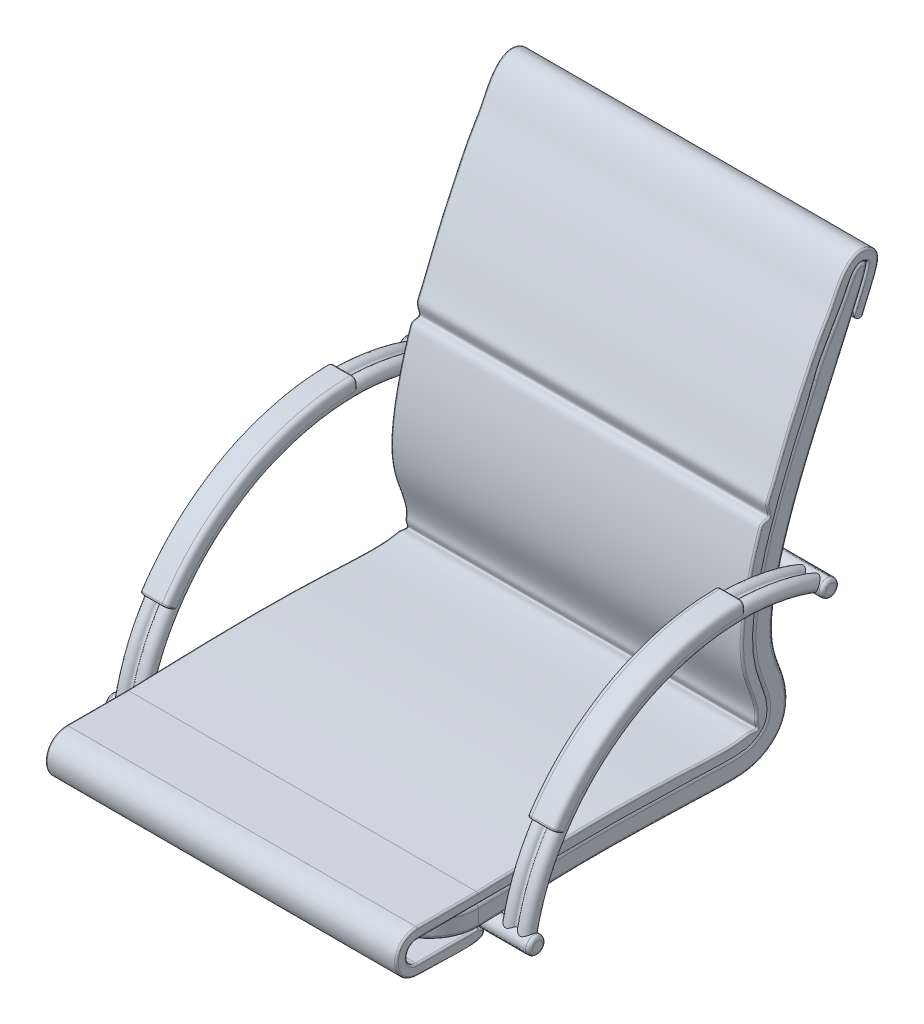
SolidWorks part; units mm, degrees
ref_plane "Front Plane" through (0, 0, 0) normal (0, 0, 1) x (1, 0, 0)
ref_plane "Top Plane" through (0, 0, 0) normal (0, 1, 0) x (1, 0, 0)
ref_plane "Right Plane" through (0, 0, 0) normal (1, 0, 0) x (0, 0, -1)
sketch "Sketch4" plane through (0, 0, 0) normal (1, 0, 0) x (0, 0, -1)
  line L0 (218.1303, 668.8913) -> (231.2948, 8.3441) construction
  circle A0 centre (218.1303, 668.8913) radius 12.0924
  circle A1 centre (231.2948, 8.3441) radius 12.1449 construction
extrude "Boss-Extrude2" add sketch "Sketch4" along normal mid plane 606 separate body
ref_plane "Plane1" through (276, 0, 0) normal (1, 0, 0) x (0, 0, -1)
sketch "Sketch5" plane through (276, 0, 0) normal (1, 0, 0) x (0, 0, -1)
  line L0 (218.1303, 656.7989) -> (218.1303, 680.9837) construction
  circle A0 centre (218.1303, 668.8913) radius 12.0924 construction
  spline S1 degree 3 poles (-199.6989, 437.1675) (-196.5427, 454.7327) (-189.8873, 480.4216) (-176.82, 512.9804) (-164.8811, 535.9342) (-146.7072, 565.2538) (-124.7381, 592.2419) (-99.9188, 616.3121) (-79.3824, 632.3791) (-58.0783, 647.0467) (-35.6892, 659.9192) (-12.0144, 670.1434) (12.3733, 678.9136) (37.6554, 685.3594) (63.172, 690.0447) (88.9718, 691.923) (114.7332, 692.5477) (140.4632, 690.0125) (165.9734, 685.984) (188.6281, 680.4159) (205.9265, 674.4142) (214.8168, 670.5993) (218.1303, 669.0613) knots 0 0 0 0 0.099648 0.147663 0.195628 0.243945 0.340141 0.388961 0.436781 0.485552 0.533339 0.580717 0.629379 0.677921 0.726265 0.774036 0.822241 0.869971 0.918165 0.966412 1 1.020341 1.020341 1.020341 1.020341
ref_plane "Plane2" through (276, 437.1675, 199.6989) normal (0, 0.9842, -0.1769) x (-1, 0, 0)
sketch "Sketch6" plane through (276, 437.1675, 199.6989) normal (0, 0.9842, -0.1769) x (-1, 0, 0)
  line L6 (20.4166, 0) -> (0.3884, 0) construction
  line L7 (0, 0) -> (0, 0.9296) construction
  line L10 (-0.3849, 5) -> (0.3849, 5)
  line L11 (-0.3849, -5) -> (0.3849, -5)
  arc A0 (2.3861, -6.0017) -> (2.3861, 6.0017) centre (10.4025, 0) ccw
  arc A1 (-2.3861, -6.0017) -> (-2.3861, 6.0017) centre (-10.4025, 0) cw
  arc A2 (2.3861, -6.0017) -> (0.3849, -5) centre (0.3849, -7.5) ccw
  arc A3 (-2.3861, -6.0017) -> (-0.3849, -5) centre (-0.3849, -7.5) cw
  arc A4 (2.3861, 6.0017) -> (0.3849, 5) centre (0.3849, 7.5) cw
  arc A5 (-2.3861, 6.0017) -> (-0.3849, 5) centre (-0.3849, 7.5) ccw
  dimension "D1" = 2.5
sketch "Sketch2" plane through (0, 0, 0) normal (1, 0, 0) x (0, 0, -1)
  arc A0 (-302.7004, 447.073) -> (-302.8358, 477.0727) centre (-302.768, 462.0728) cw
  spline S0 degree 3 poles (-302.768, 462.0728) (-254.4457, 462.291) (-173.1643, 465.1968) (-60.3682, 468.2628) (28.1402, 466.1167) (95.8151, 463.9645) (137.6273, 462.2826) (161.3142, 466.099) (177.9271, 474.807) (191.2571, 488.7092) (195.9209, 508.6286) (194.0692, 533.8347) (181.9926, 559.9308) (171.6561, 602.0238) (176.8481, 649.3974) (191.4753, 706.434) (212.6276, 768.554) (238.3255, 828.8707) (274.2937, 907.0396) (299.4763, 958.7263) (317.708, 996.574) knots 0 0 0 0 0.139411 0.234711 0.325542 0.394767 0.430232 0.446073 0.463281 0.483676 0.499234 0.520862 0.555435 0.581355 0.645155 0.68964 0.751713 0.834106 0.878774 1 1 1 1 construction
  spline S2 degree 3 number of poles 65 (-302.7004, 447.073) -> (265.2147, 851.3283)
  spline S4 degree 3 poles (-302.8358, 477.0727) (-292.0663, 477.1213) (-270.54, 477.369) (-227.3985, 478.3123) (-173.3608, 480.0335) (-119.1146, 481.7129) (-75.5578, 482.4358) (-42.7989, 482.4694) (-10.1258, 481.9926) (22.4709, 481.1965) (49.5556, 480.4101) (71.2346, 479.7336) (87.5038, 479.1907) (101.0563, 478.7138) (111.9355, 478.2995) (119.8779, 478.0291) (127.6177, 477.9159) (135.1406, 478.0514) (141.2527, 478.4479) (146.0026, 478.9689) (149.3577, 479.4731) (152.5123, 480.1146) (155.425, 480.9002) (158.142, 481.8563) (161.7542, 483.4398) (166.1215, 485.9539) (170.2403, 489.15) (172.9882, 491.8447) (174.757, 493.9117) (175.9591, 495.6331) (176.7585, 497.0016) (177.4406, 498.3393) (178.2025, 500.2112) (178.9544, 502.7818) (179.5239, 505.6281) (180.0354, 509.7542) (180.1877, 515.064) (179.7125, 520.4534) (178.9806, 524.7698) (178.0217, 529.071) (176.3732, 534.6772) (173.8388, 541.7893) (170.9605, 549.3431) (168.4855, 556.0807) (166.6316, 561.7474) (164.9304, 567.4447) (163.0775, 574.6813) (161.3382, 583.5114) (160.1339, 592.4791) (159.2507, 604.3805) (159.3374, 619.1555) (160.9298, 636.5856) (163.6168, 653.6226) (168.1318, 675.7027) (175.1793, 702.5561) (185.0612, 734.1263) (196.1577, 765.29) (208.2138, 795.9408) (225.1757, 835.9888) (238.6121, 865.467) (247.6824, 884.9305) knots 0 0 0 0 0.03125 0.0625 0.125 0.1875 0.21875 0.25 0.28125 0.3125 0.34375 0.359375 0.375 0.390625 0.398438 0.40625 0.414062 0.421875 0.429688 0.433594 0.4375 0.441406 0.445312 0.449219 0.453125 0.460938 0.46875 0.472656 0.476562 0.480469 0.482422 0.484375 0.488281 0.492188 0.496094 0.5 0.507812 0.515625 0.519531 0.523438 0.53125 0.539062 0.546875 0.554688 0.558594 0.5625 0.570312 0.578125 0.585938 0.59375 0.609375 0.625 0.640625 0.65625 0.6875 0.71875 0.75 0.78125 0.8125 0.874209 0.874209 0.874209 0.874209
  spline S5 degree 3 poles (247.6824, 884.9305) (260.0079, 917.9066) (285.1481, 950.0096) (302.7474, 992.2646) (313.1618, 997.7348) (317.8391, 996.6841) (320.5436, 995.2701) (323.0924, 994.2624) (324.3018, 992.1736) (323.5022, 988.3225) (321.897, 981.468) (316.8688, 968.57) (307.5815, 946.9094) (289.7463, 906.8502) (274.8552, 873.5253) (265.2147, 851.3283) knots 0 0 0 0 0.347874 0.422119 0.446285 0.457369 0.469073 0.477455 0.484417 0.491273 0.516071 0.556561 0.630422 0.755115 1 1 1 1
sweep "Sweep3" add profiles "Sketch6" path "Sketch5"
ref_plane "Plane3" through (250, 0, 0) normal (1, 0, 0) x (0, 0, -1)
sketch "Sketch7" plane through (250, 0, 0) normal (1, 0, 0) x (0, 0, -1)
  arc A0 (-232.2731, 478.2649) -> (-231.282, 448.2874) centre (-232.2731, 463.2598) ccw
  spline S0 degree 1 poles (-231.543, 458.284) (255.9032, 855.3113) knots 0 0 1 1 construction
  spline S1 degree 3 poles (247.6824, 884.9305) (260.0079, 917.9066) (285.1481, 950.0096) (302.7474, 992.2646) (313.1618, 997.7348) (317.8391, 996.6841) (320.5436, 995.2701) (323.0924, 994.2624) (324.3018, 992.1736) (323.5022, 988.3225) (321.8971, 981.468) (316.8685, 968.5701) (307.5842, 946.9082) (289.6874, 906.7854) (274.8938, 873.3268) (264.9972, 851.1521) knots 0 0 0 0 0.347582 0.421765 0.44591 0.456985 0.46868 0.477054 0.48401 0.490861 0.515638 0.556094 0.629893 0.754481 1 1 1 1
  spline S2 degree 3 poles (-231.543, 458.284) (-214.5776, 458.7271) (-180.6414, 459.7711) (-129.796, 461.3657) (-87.4532, 462.2791) (-53.6241, 462.4178) (-28.2337, 462.201) (-2.828, 461.7221) (22.5779, 461.0754) (48.0034, 460.3385) (73.4009, 459.5358) (94.6065, 458.8163) (111.5185, 458.1566) (124.3884, 457.7453) (135.2405, 457.8819) (144.0017, 458.5027) (150.6288, 459.2832) (157.3256, 460.5595) (166.2059, 463.2312) (174.5012, 467.4856) (182.0062, 473.003) (187.225, 477.832) (191.0191, 482.4559) (193.5954, 486.5117) (195.8255, 490.8439) (197.8126, 496.4901) (199.1929, 503.4257) (199.7977, 510.3181) (199.7531, 517.1893) (199.1005, 523.9538) (197.872, 530.6639) (196.1831, 537.0935) (193.4685, 545.448) (190.3971, 553.4733) (187.4755, 561.3438) (184.8307, 569.1648) (182.1388, 579.0969) (179.273, 595.1773) (178.5907, 615.696) (181.2366, 640.7269) (186.085, 665.5888) (192.2644, 689.9565) (199.4739, 714.1593) (207.4689, 738.1677) (219.0709, 769.9015) (235.0436, 808.9994) (248.8647, 839.9219) (255.9032, 855.3113) knots 0.068734 0.068734 0.068734 0.068734 0.117683 0.166633 0.215582 0.240057 0.264532 0.289006 0.313481 0.337956 0.362431 0.386906 0.399143 0.41138 0.423618 0.429736 0.435855 0.441974 0.448092 0.46033 0.466448 0.472567 0.478686 0.481745 0.484805 0.490923 0.497042 0.503161 0.509279 0.515398 0.521517 0.527635 0.533754 0.545991 0.55211 0.558229 0.570466 0.582704 0.607178 0.631653 0.656128 0.680603 0.705077 0.729552 0.754027 0.802976 0.851926 0.851926 0.851926 0.851926 construction
  spline S3 degree 3 poles (-232.2731, 478.2649) (-212.6501, 478.782) (-171.383, 480.0947) (-119.1146, 481.7129) (-75.5578, 482.4358) (-42.7989, 482.4694) (-10.1258, 481.9926) (22.4709, 481.1965) (49.5556, 480.4101) (71.2346, 479.7336) (87.5038, 479.1907) (101.0563, 478.7138) (111.9355, 478.2995) (119.8779, 478.0291) (127.6177, 477.9159) (135.1406, 478.0514) (141.2527, 478.4479) (146.0026, 478.9689) (149.3577, 479.4731) (152.5123, 480.1146) (155.425, 480.9002) (158.142, 481.8563) (161.7542, 483.4398) (166.1215, 485.9539) (170.2403, 489.15) (172.9882, 491.8447) (174.757, 493.9117) (175.9591, 495.6331) (176.7585, 497.0016) (177.4406, 498.3393) (178.2025, 500.2112) (178.9544, 502.7818) (179.5239, 505.6281) (180.0354, 509.7542) (180.1877, 515.064) (179.7125, 520.4534) (178.9806, 524.7698) (178.0217, 529.071) (176.3732, 534.6772) (173.8388, 541.7893) (170.9605, 549.3431) (168.4855, 556.0807) (166.6316, 561.7474) (164.9304, 567.4447) (163.0775, 574.6813) (161.3382, 583.5114) (160.1339, 592.4791) (159.2507, 604.3805) (159.3374, 619.1555) (160.9298, 636.5856) (163.6168, 653.6226) (168.1318, 675.7027) (175.1793, 702.5561) (185.0612, 734.1263) (196.1577, 765.29) (208.2138, 795.9408) (225.1757, 835.9888) (238.6121, 865.467) (247.6824, 884.9305) knots 0.068197 0.068197 0.068197 0.068197 0.125 0.1875 0.21875 0.25 0.28125 0.3125 0.34375 0.359375 0.375 0.390625 0.398438 0.40625 0.414062 0.421875 0.429688 0.433594 0.4375 0.441406 0.445312 0.449219 0.453125 0.460938 0.46875 0.472656 0.476562 0.480469 0.482422 0.484375 0.488281 0.492188 0.496094 0.5 0.507812 0.515625 0.519531 0.523438 0.53125 0.539062 0.546875 0.554688 0.558594 0.5625 0.570312 0.578125 0.585938 0.59375 0.609375 0.625 0.640625 0.65625 0.6875 0.71875 0.75 0.78125 0.8125 0.874209 0.874209 0.874209 0.874209
  spline S4 degree 3 poles (-231.282, 448.2874) (-211.7381, 448.7979) (-181.3855, 449.7535) (-140.2881, 451.0176) (-107.9187, 451.8553) (-75.6149, 452.3787) (-43.3952, 452.4007) (-11.0883, 451.9186) (21.2816, 451.1169) (48.3069, 450.3228) (69.9109, 449.641) (86.1106, 449.0948) (99.6259, 448.6145) (110.4113, 448.1999) (118.7212, 447.913) (127.2316, 447.7825) (135.953, 447.9327) (143.3667, 448.4057) (149.4325, 449.0656) (154.1462, 449.7671) (158.9693, 450.7395) (163.8973, 452.0579) (168.8356, 453.7911) (175.1466, 456.5612) (181.1143, 460.0035) (186.6569, 464.0101) (190.6855, 467.371) (194.5226, 471.1182) (198.1017, 475.2796) (200.8006, 479.1209) (202.7356, 482.4214) (204.5093, 485.898) (206.283, 490.3034) (207.8111, 495.5753) (208.8412, 500.7818) (209.6736, 507.532) (209.9033, 515.8662) (209.0409, 525.651) (207.1467, 535.1747) (204.5285, 543.9911) (201.6035, 552.1816) (198.6791, 559.8602) (196.4758, 565.8831) (194.9534, 570.5461) (193.5478, 575.2583) (192.0383, 581.1679) (190.6403, 588.2884) (189.687, 595.4042) (188.9684, 605.0792) (189.0341, 617.451) (190.4158, 632.6411) (192.8428, 648.0414) (196.0012, 663.4717) (199.7115, 678.7512) (203.9109, 693.9984) (208.492, 709.2347) (215.0398, 729.4547) (223.9931, 754.5696) (235.738, 784.4023) (248.2854, 814.0097) (258.1931, 836.2257) (263.8251, 848.5893) (264.9972, 851.1521) knots 0.068734 0.068734 0.068734 0.068734 0.125 0.15625 0.1875 0.21875 0.25 0.28125 0.3125 0.34375 0.359375 0.375 0.390625 0.398438 0.40625 0.414062 0.421875 0.429688 0.433594 0.4375 0.441406 0.445312 0.449219 0.453125 0.460938 0.464844 0.46875 0.472656 0.476562 0.480469 0.482422 0.484375 0.488281 0.492188 0.496094 0.5 0.507812 0.515625 0.523438 0.53125 0.539062 0.546875 0.554688 0.558594 0.5625 0.570312 0.578125 0.585938 0.59375 0.609375 0.625 0.640625 0.65625 0.671875 0.6875 0.703125 0.71875 0.75 0.78125 0.8125 0.84375 0.851926 0.851926 0.851926 0.851926
  spline S5 degree 1 poles (255.9032, 855.3113) (320.8828, 995.1747) knots 0 0 1 1 construction
  dimension "D1" = 10
ref_plane "Plane4" through (0, 458.284, 0) normal (0, 1, 0) x (-1, 0, 0)
sketch "Sketch15" plane through (0, 0, 0) normal (1, 0, 0) x (0, 0, -1)
  line L2 (-231.5473, 478.284) -> (-318.0944, 478.284)
  line L3 (-318.0944, 478.284) -> (-318.0944, 448.284) construction
  line L4 (-231.282, 448.2874) -> (-318.0944, 448.284)
  arc A2 (-318.0944, 478.284) -> (-318.0944, 448.284) centre (-318.0944, 463.284) ccw
  spline S0 degree 3 poles (-1339.2757, 1942.9487) (-1115.4265, 434.5387) (-627.1483, 445.7679) (-129.796, 461.3657) (-87.4532, 462.2791) (-53.6241, 462.4178) (-28.2337, 462.201) (-2.828, 461.7221) (22.5779, 461.0754) (48.0034, 460.3385) (73.4009, 459.5358) (94.6065, 458.8163) (111.5185, 458.1566) (124.3884, 457.7453) (135.2405, 457.8819) (144.0017, 458.5027) (150.6288, 459.2832) (157.3256, 460.5595) (166.2059, 463.2312) (174.5012, 467.4856) (182.0062, 473.003) (187.225, 477.832) (191.0191, 482.4559) (193.5954, 486.5117) (195.8255, 490.8439) (197.8126, 496.4901) (199.1929, 503.4257) (199.7977, 510.3181) (199.7531, 517.1893) (199.1005, 523.9538) (197.872, 530.6639) (196.1831, 537.0935) (193.4685, 545.448) (190.3971, 553.4733) (187.4755, 561.3438) (184.8307, 569.1648) (182.1388, 579.0969) (179.273, 595.1773) (178.5907, 615.696) (181.2366, 640.7269) (186.085, 665.5888) (192.2644, 689.9565) (199.4739, 714.1593) (207.4689, 738.1677) (219.0709, 769.9015) (394.9978, 1200.5344) (758.3138, 1558.336) (-1059.8073, 2143.3321) knots -1.220838 -1.220838 -1.220838 -1.220838 0.117683 0.166633 0.215582 0.240057 0.264532 0.289006 0.313481 0.337956 0.362431 0.386906 0.399143 0.41138 0.423618 0.429736 0.435855 0.441974 0.448092 0.46033 0.466448 0.472567 0.478686 0.481745 0.484805 0.490923 0.497042 0.503161 0.509279 0.515398 0.521517 0.527635 0.533754 0.545991 0.55211 0.558229 0.570466 0.582704 0.607178 0.631653 0.656128 0.680603 0.705077 0.729552 0.754027 0.802976 2.077404 2.077404 2.077404 2.077404 only from (-231.543, 458.284) to (255.9032, 855.3113) construction
  spline S1 degree 1 poles (-586.773, -958.4805) (1163.5548, 2808.9573) knots -12.96831 -12.96831 13.968244 13.968244 only from (255.9032, 855.3113) to (320.8828, 995.1747) construction
  spline S2 degree 3 poles (-231.543, 458.284) (-214.5776, 458.7271) (-180.6414, 459.7711) (-129.796, 461.3657) (-87.4532, 462.2791) (-53.6241, 462.4178) (-28.2337, 462.201) (-2.828, 461.7221) (22.5779, 461.0754) (48.0034, 460.3385) (73.4009, 459.5358) (94.6065, 458.8163) (111.5185, 458.1566) (124.3884, 457.7453) (135.2405, 457.8819) (144.0017, 458.5027) (150.6288, 459.2832) (157.3256, 460.5595) (166.2059, 463.2312) (174.5012, 467.4856) (182.0062, 473.003) (187.225, 477.832) (191.0191, 482.4559) (193.5954, 486.5117) (195.8255, 490.8439) (197.8126, 496.4901) (199.1929, 503.4257) (199.7977, 510.3181) (199.7531, 517.1893) (199.1005, 523.9538) (197.872, 530.6639) (196.1831, 537.0935) (193.4685, 545.448) (190.3971, 553.4733) (187.4755, 561.3438) (184.8307, 569.1648) (182.1388, 579.0969) (179.273, 595.1773) (178.5907, 615.696) (181.2366, 640.7269) (186.085, 665.5888) (192.2644, 689.9565) (199.4739, 714.1593) (207.4689, 738.1677) (219.0709, 769.9015) (235.0436, 808.9994) (248.8647, 839.9219) (255.9032, 855.3113) knots 0.068734 0.068734 0.068734 0.068734 0.117683 0.166633 0.215582 0.240057 0.264532 0.289006 0.313481 0.337956 0.362431 0.386906 0.399143 0.41138 0.423618 0.429736 0.435855 0.441974 0.448092 0.46033 0.466448 0.472567 0.478686 0.481745 0.484805 0.490923 0.497042 0.503161 0.509279 0.515398 0.521517 0.527635 0.533754 0.545991 0.55211 0.558229 0.570466 0.582704 0.607178 0.631653 0.656128 0.680603 0.705077 0.729552 0.754027 0.802976 0.851926 0.851926 0.851926 0.851926 construction
  spline S3 degree 1 poles (255.9032, 855.3113) (320.8828, 995.1747) knots 0 0 1 1 construction
  spline S4 degree 3 poles (-1582.991, 1809.1728) (-1057.6469, 448.0622) (-603.7514, 466.7089) (-119.1146, 481.7129) (-75.5578, 482.4358) (-42.7989, 482.4694) (-10.1258, 481.9926) (22.4709, 481.1965) (49.5556, 480.4101) (71.2346, 479.7336) (87.5038, 479.1907) (101.0563, 478.7138) (111.9355, 478.2995) (119.8779, 478.0291) (127.6177, 477.9159) (135.1406, 478.0514) (141.2527, 478.4479) (146.0026, 478.9689) (149.3577, 479.4731) (152.5123, 480.1146) (155.425, 480.9002) (158.142, 481.8563) (161.7542, 483.4398) (166.1215, 485.9539) (170.2403, 489.15) (172.9882, 491.8447) (174.757, 493.9117) (175.9591, 495.6331) (176.7585, 497.0016) (177.4406, 498.3393) (178.2025, 500.2112) (178.9544, 502.7818) (179.5239, 505.6281) (180.0354, 509.7542) (180.1877, 515.064) (179.7125, 520.4534) (178.9806, 524.7698) (178.0217, 529.071) (176.3732, 534.6772) (173.8388, 541.7893) (170.9605, 549.3431) (168.4855, 556.0807) (166.6316, 561.7474) (164.9304, 567.4447) (163.0775, 574.6813) (161.3382, 583.5114) (160.1339, 592.4791) (159.2507, 604.3805) (159.3374, 619.1555) (160.9298, 636.5856) (163.6168, 653.6226) (168.1318, 675.7027) (175.1793, 702.5561) (185.0612, 734.1263) (196.1577, 765.29) (208.2138, 795.9408) (387.4175, 1219.0509) (703.2546, 1538.2757) (-317.4105, 2695.2344) knots -1.17719 -1.17719 -1.17719 -1.17719 0.125 0.1875 0.21875 0.25 0.28125 0.3125 0.34375 0.359375 0.375 0.390625 0.398438 0.40625 0.414062 0.421875 0.429688 0.433594 0.4375 0.441406 0.445312 0.449219 0.453125 0.460938 0.46875 0.472656 0.476562 0.480469 0.482422 0.484375 0.488281 0.492188 0.496094 0.5 0.507812 0.515625 0.519531 0.523438 0.53125 0.539062 0.546875 0.554688 0.558594 0.5625 0.570312 0.578125 0.585938 0.59375 0.609375 0.625 0.640625 0.65625 0.6875 0.71875 0.75 0.78125 0.8125 2.062278 2.062278 2.062278 2.062278 only from (-232.2731, 478.2649) to (247.6824, 884.9305) construction
  spline S5 degree 3 poles (-1575.0065, 1776.4729) (-1083.4432, 416.9555) (-609.4025, 436.5882) (-140.2881, 451.0176) (-107.9187, 451.8553) (-75.6149, 452.3787) (-43.3952, 452.4007) (-11.0883, 451.9186) (21.2816, 451.1169) (48.3069, 450.3228) (69.9109, 449.641) (86.1106, 449.0948) (99.6259, 448.6145) (110.4113, 448.1999) (118.7212, 447.913) (127.2316, 447.7825) (135.953, 447.9327) (143.3667, 448.4057) (149.4325, 449.0656) (154.1462, 449.7671) (158.9693, 450.7395) (163.8973, 452.0579) (168.8356, 453.7911) (175.1466, 456.5612) (181.1143, 460.0035) (186.6569, 464.0101) (190.6855, 467.371) (194.5226, 471.1182) (198.1017, 475.2796) (200.8006, 479.1209) (202.7356, 482.4214) (204.5093, 485.898) (206.283, 490.3034) (207.8111, 495.5753) (208.8412, 500.7818) (209.6736, 507.532) (209.9033, 515.8662) (209.0409, 525.651) (207.1467, 535.1747) (204.5285, 543.9911) (201.6035, 552.1816) (198.6791, 559.8602) (196.4758, 565.8831) (194.9534, 570.5461) (193.5478, 575.2583) (192.0383, 581.1679) (190.6403, 588.2884) (189.687, 595.4042) (188.9684, 605.0792) (189.0341, 617.451) (190.4158, 632.6411) (192.8428, 648.0414) (196.0012, 663.4717) (199.7115, 678.7512) (203.9109, 693.9984) (208.492, 709.2347) (215.0398, 729.4547) (223.9931, 754.5696) (235.738, 784.4023) (248.2854, 814.0097) (449.498, 1265.187) (779.6241, 1669.4608) (-433.9812, 2529.4885) knots -1.16818 -1.16818 -1.16818 -1.16818 0.125 0.15625 0.1875 0.21875 0.25 0.28125 0.3125 0.34375 0.359375 0.375 0.390625 0.398438 0.40625 0.414062 0.421875 0.429688 0.433594 0.4375 0.441406 0.445312 0.449219 0.453125 0.460938 0.464844 0.46875 0.472656 0.476562 0.480469 0.482422 0.484375 0.488281 0.492188 0.496094 0.5 0.507812 0.515625 0.523438 0.53125 0.539062 0.546875 0.554688 0.558594 0.5625 0.570312 0.578125 0.585938 0.59375 0.609375 0.625 0.640625 0.65625 0.671875 0.6875 0.703125 0.71875 0.75 0.78125 0.8125 0.84375 2.216587 2.216587 2.216587 2.216587 only from (-231.282, 448.2874) to (264.9972, 851.1521) construction
  spline S6 degree 3 poles (1493.8874, -665.4537) (-6.7071, 790.7566) (228.9254, 815.0218) (302.7474, 992.2646) (313.1618, 997.7348) (317.8391, 996.6841) (320.5436, 995.2701) (323.0924, 994.2624) (324.3018, 992.1736) (323.5022, 988.3225) (321.8971, 981.468) (316.8685, 968.5701) (307.5842, 946.9082) (102.1454, 486.3364) (-76.7723, 31.3012) (-1333.5328, -227.4093) knots -1.424507 -1.424507 -1.424507 -1.424507 0.347582 0.421765 0.44591 0.456985 0.46868 0.477054 0.48401 0.490861 0.515638 0.556094 0.629893 0.754481 5.651716 5.651716 5.651716 5.651716 only from (247.6824, 884.9305) to (264.9972, 851.1521) construction
  spline S7 degree 3 poles (-231.5473, 478.284) (-212.1656, 478.7974) (-171.1399, 480.1022) (-119.1146, 481.7129) (-75.5578, 482.4358) (-42.7989, 482.4694) (-10.1258, 481.9926) (22.4709, 481.1965) (49.5556, 480.4101) (71.2346, 479.7336) (87.5038, 479.1907) (101.0563, 478.7138) (111.9355, 478.2995) (119.8779, 478.0291) (127.6177, 477.9159) (135.1406, 478.0514) (141.2527, 478.4479) (146.0026, 478.9689) (149.3577, 479.4731) (152.5123, 480.1146) (155.425, 480.9002) (158.142, 481.8563) (161.7542, 483.4398) (166.1215, 485.9539) (170.2403, 489.15) (172.9882, 491.8447) (174.757, 493.9117) (175.9591, 495.6331) (176.7585, 497.0016) (177.4406, 498.3393) (178.2025, 500.2112) (178.9544, 502.7818) (179.5239, 505.6281) (180.0354, 509.7542) (180.1877, 515.064) (179.7125, 520.4534) (178.9806, 524.7698) (178.0217, 529.071) (176.3732, 534.6772) (173.8388, 541.7893) (170.9605, 549.3431) (168.4855, 556.0807) (166.6316, 561.7474) (164.9304, 567.4447) (163.0775, 574.6813) (161.3382, 583.5114) (160.1339, 592.4791) (159.2507, 604.3805) (159.3374, 619.1555) (160.9298, 636.5856) (163.6168, 653.6226) (168.1318, 675.7027) (175.1793, 702.5561) (185.0612, 734.1263) (196.1577, 765.29) (208.2138, 795.9408) (225.1757, 835.9888) (238.6121, 865.467) (247.6824, 884.9305) knots 0.068897 0.068897 0.068897 0.068897 0.125 0.1875 0.21875 0.25 0.28125 0.3125 0.34375 0.359375 0.375 0.390625 0.398438 0.40625 0.414062 0.421875 0.429688 0.433594 0.4375 0.441406 0.445312 0.449219 0.453125 0.460938 0.46875 0.472656 0.476562 0.480469 0.482422 0.484375 0.488281 0.492188 0.496094 0.5 0.507812 0.515625 0.519531 0.523438 0.53125 0.539062 0.546875 0.554688 0.558594 0.5625 0.570312 0.578125 0.585938 0.59375 0.609375 0.625 0.640625 0.65625 0.6875 0.71875 0.75 0.78125 0.8125 0.874209 0.874209 0.874209 0.874209
  spline S8 degree 3 poles (-231.282, 448.2874) (-211.7381, 448.7979) (-181.3855, 449.7535) (-140.2881, 451.0176) (-107.9187, 451.8553) (-75.6149, 452.3787) (-43.3952, 452.4007) (-11.0883, 451.9186) (21.2816, 451.1169) (48.3069, 450.3228) (69.9109, 449.641) (86.1106, 449.0948) (99.6259, 448.6145) (110.4113, 448.1999) (118.7212, 447.913) (127.2316, 447.7825) (135.953, 447.9327) (143.3667, 448.4057) (149.4325, 449.0656) (154.1462, 449.7671) (158.9693, 450.7395) (163.8973, 452.0579) (168.8356, 453.7911) (175.1466, 456.5612) (181.1143, 460.0035) (186.6569, 464.0101) (190.6855, 467.371) (194.5226, 471.1182) (198.1017, 475.2796) (200.8006, 479.1209) (202.7356, 482.4214) (204.5093, 485.898) (206.283, 490.3034) (207.8111, 495.5753) (208.8412, 500.7818) (209.6736, 507.532) (209.9033, 515.8662) (209.0409, 525.651) (207.1467, 535.1747) (204.5285, 543.9911) (201.6035, 552.1816) (198.6791, 559.8602) (196.4758, 565.8831) (194.9534, 570.5461) (193.5478, 575.2583) (192.0383, 581.1679) (190.6403, 588.2884) (189.687, 595.4042) (188.9684, 605.0792) (189.0341, 617.451) (190.4158, 632.6411) (192.8428, 648.0414) (196.0012, 663.4717) (199.7115, 678.7512) (203.9109, 693.9984) (208.492, 709.2347) (215.0398, 729.4547) (223.9931, 754.5696) (235.738, 784.4023) (248.2854, 814.0097) (258.1931, 836.2257) (263.8251, 848.5893) (264.9972, 851.1521) knots 0.068734 0.068734 0.068734 0.068734 0.125 0.15625 0.1875 0.21875 0.25 0.28125 0.3125 0.34375 0.359375 0.375 0.390625 0.398438 0.40625 0.414062 0.421875 0.429688 0.433594 0.4375 0.441406 0.445312 0.449219 0.453125 0.460938 0.464844 0.46875 0.472656 0.476562 0.480469 0.482422 0.484375 0.488281 0.492188 0.496094 0.5 0.507812 0.515625 0.523438 0.53125 0.539062 0.546875 0.554688 0.558594 0.5625 0.570312 0.578125 0.585938 0.59375 0.609375 0.625 0.640625 0.65625 0.671875 0.6875 0.703125 0.71875 0.75 0.78125 0.8125 0.84375 0.851926 0.851926 0.851926 0.851926
  spline S9 degree 3 poles (247.6824, 884.9305) (260.0079, 917.9066) (285.1481, 950.0096) (302.7474, 992.2646) (313.1618, 997.7348) (317.8391, 996.6841) (320.5436, 995.2701) (323.0924, 994.2624) (324.3018, 992.1736) (323.5022, 988.3225) (321.8971, 981.468) (316.8685, 968.5701) (307.5842, 946.9082) (289.6874, 906.7854) (274.8938, 873.3268) (264.9972, 851.1521) knots 0 0 0 0 0.347582 0.421765 0.44591 0.456985 0.46868 0.477054 0.48401 0.490861 0.515638 0.556094 0.629893 0.754481 1 1 1 1
extrude "Boss-Extrude5" add sketch "Sketch15" along normal mid plane 500 separate body
sketch "Sketch16" plane through (0, 0, 0) normal (0, 1, 0) x (1, 0, 0)
  line L0 (0, 414.0283) -> (0, -328.0992) construction
  line L2 (0, -328.0992) -> (250, -333.0944) construction
  spline S0 degree 3 poles (0, -328.0992) (89.9786, -327.8805) (249.9663, -324.8422) (250, -231.282) knots 0 0 0 0 1 1 1 1
  spline S1 degree 3 poles (0, -328.0992) (-89.9786, -327.8805) (-249.9663, -324.8422) (-250, -231.282) knots 0 0 0 0 1 1 1 1
extrude "Cut-Extrude1" cut sketch "Sketch16" along normal through all flip side to cut
sketch "Sketch9" plane through (303, 0, 0) normal (1, 0, 0) x (0, 0, -1)
  line L0 (218.1303, 668.8913) -> (218.1303, -51.5666) construction
  circle A0 centre (-199.811, 437.032) radius 12.0981
fillet "Fillet9" radius 5 16 edges at (225.3247, 448.2854, 284.3799) (29.999, 451.8833, 327.8424) (-113.4077, 449.0108, 322.7068) (-229.9265, 448.2855, 280.1033) (-29.999, 474.6848, 327.8424) (113.4077, 477.5573, 322.7068)
sketch "Sketch10" plane through (0, 0, 0) normal (1, 0, 0) x (0, 0, -1)
  line L0 (-231.5473, 478.284) -> (-318.0944, 478.284) construction
  line L1 (-231.282, 448.2874) -> (-318.0944, 448.284) construction
  line L2 (-231.5473, 478.284) -> (-318.0944, 478.284)
  line L3 (-231.282, 448.2874) -> (-318.0944, 448.284)
  line L4 (-231.746, 493.284) -> (-318.0944, 493.284) construction
  line L5 (-231.2814, 433.2874) -> (-318.0941, 433.284) construction
  arc A0 (-318.0944, 478.284) -> (-318.0944, 448.284) centre (-318.0944, 463.284) ccw construction
  arc A2 (-318.0944, 478.284) -> (-318.0944, 448.284) centre (-318.0944, 463.284) ccw
  arc A3 (-318.0944, 493.284) -> (-318.0941, 433.284) centre (-318.0943, 463.284) ccw construction
  spline S0 degree 3 poles (304.5979, 940.2947) (301.5046, 931.3991) (313.5843, 926.2605) (318.1648, 933.8845) knots 0 0 0 0 1 1 1 1
  spline S1 degree 3 poles (-231.282, 448.2874) (-220.0626, 446.6936) (-219.1745, 435.2452) (-231.2814, 433.2874) knots 0 0 0 0 1 1 1 1
  spline S2 degree 1 poles (-231.2814, 433.2874) (-318.0941, 433.284) knots 0 0 1 1
  spline S3 degree 3 poles (-318.0941, 433.284) (-358.2779, 435.1755) (-357.7168, 491.9549) (-318.0944, 493.284) knots 0 0 0 0 1 1 1 1
  spline S4 degree 3 poles (-1582.7245, 1808.4823) (-1057.5004, 448.0682) (-603.675, 466.7113) (-119.1146, 481.7129) (-75.5578, 482.4358) (-42.7989, 482.4694) (-10.1258, 481.9926) (22.4709, 481.1965) (49.5556, 480.4101) (71.2346, 479.7336) (87.5038, 479.1907) (101.0563, 478.7138) (111.9355, 478.2995) (119.8779, 478.0291) (127.6177, 477.9159) (135.1406, 478.0514) (141.2527, 478.4479) (146.0026, 478.9689) (149.3577, 479.4731) (152.5123, 480.1146) (155.425, 480.9002) (158.142, 481.8563) (161.7542, 483.4398) (166.1215, 485.9539) (170.2403, 489.15) (172.9882, 491.8447) (174.757, 493.9117) (175.9591, 495.6331) (176.7585, 497.0016) (177.4406, 498.3393) (178.2025, 500.2112) (178.9544, 502.7818) (179.5239, 505.6281) (180.0354, 509.7542) (180.1877, 515.064) (179.7125, 520.4534) (178.9806, 524.7698) (178.0217, 529.071) (176.3732, 534.6772) (173.8388, 541.7893) (170.9605, 549.3431) (168.4855, 556.0807) (166.6316, 561.7474) (164.9304, 567.4447) (163.0775, 574.6813) (161.3382, 583.5114) (160.1339, 592.4791) (159.2507, 604.3805) (159.3374, 619.1555) (160.9298, 636.5856) (163.6168, 653.6226) (168.1318, 675.7027) (175.1793, 702.5561) (185.0612, 734.1263) (196.1577, 765.29) (208.2138, 795.9408) (387.4191, 1219.0545) (703.2602, 1538.2813) (-317.4382, 2695.2658) knots -1.17697 -1.17697 -1.17697 -1.17697 0.125 0.1875 0.21875 0.25 0.28125 0.3125 0.34375 0.359375 0.375 0.390625 0.398438 0.40625 0.414062 0.421875 0.429688 0.433594 0.4375 0.441406 0.445312 0.449219 0.453125 0.460938 0.46875 0.472656 0.476562 0.480469 0.482422 0.484375 0.488281 0.492188 0.496094 0.5 0.507812 0.515625 0.519531 0.523438 0.53125 0.539062 0.546875 0.554688 0.558594 0.5625 0.570312 0.578125 0.585938 0.59375 0.609375 0.625 0.640625 0.65625 0.6875 0.71875 0.75 0.78125 0.8125 2.062289 2.062289 2.062289 2.062289 only from (-231.5473, 478.284) to (247.6824, 884.9305) construction
  spline S5 degree 3 poles (1493.8874, -665.4537) (-6.7071, 790.7566) (228.9254, 815.0218) (302.7474, 992.2646) (313.1618, 997.7348) (317.8391, 996.6841) (320.5436, 995.2701) (323.0924, 994.2624) (324.3018, 992.1736) (323.5022, 988.3225) (321.8971, 981.468) (316.8685, 968.5701) (307.5842, 946.9082) (102.1454, 486.3364) (-76.7723, 31.3012) (-1333.5328, -227.4093) knots -1.424507 -1.424507 -1.424507 -1.424507 0.347582 0.421765 0.44591 0.456985 0.46868 0.477054 0.48401 0.490861 0.515638 0.556094 0.629893 0.754481 5.651716 5.651716 5.651716 5.651716 only from (247.6824, 884.9305) to (264.9972, 851.1521) construction
  spline S6 degree 3 poles (-231.5473, 478.284) (-212.1656, 478.7974) (-171.1399, 480.1022) (-119.1146, 481.7129) (-75.5578, 482.4358) (-42.7989, 482.4694) (-10.1258, 481.9926) (22.4709, 481.1965) (49.5556, 480.4101) (71.2346, 479.7336) (87.5038, 479.1907) (101.0563, 478.7138) (111.9355, 478.2995) (119.8779, 478.0291) (127.6177, 477.9159) (135.1406, 478.0514) (141.2527, 478.4479) (146.0026, 478.9689) (149.3577, 479.4731) (152.5123, 480.1146) (155.425, 480.9002) (158.142, 481.8563) (161.7542, 483.4398) (166.1215, 485.9539) (170.2403, 489.15) (172.9882, 491.8447) (174.757, 493.9117) (175.9591, 495.6331) (176.7585, 497.0016) (177.4406, 498.3393) (178.2025, 500.2112) (178.9544, 502.7818) (179.5239, 505.6281) (180.0354, 509.7542) (180.1877, 515.064) (179.7125, 520.4534) (178.9806, 524.7698) (178.0217, 529.071) (176.3732, 534.6772) (173.8388, 541.7893) (170.9605, 549.3431) (168.4855, 556.0807) (166.6316, 561.7474) (164.9304, 567.4447) (163.0775, 574.6813) (161.3382, 583.5114) (160.1339, 592.4791) (159.2507, 604.3805) (159.3374, 619.1555) (160.9298, 636.5856) (163.6168, 653.6226) (168.1318, 675.7027) (175.1793, 702.5561) (185.0612, 734.1263) (196.1577, 765.29) (208.2138, 795.9408) (225.1757, 835.9888) (238.6121, 865.467) (247.6824, 884.9305) knots 0.068897 0.068897 0.068897 0.068897 0.125 0.1875 0.21875 0.25 0.28125 0.3125 0.34375 0.359375 0.375 0.390625 0.398438 0.40625 0.414062 0.421875 0.429688 0.433594 0.4375 0.441406 0.445312 0.449219 0.453125 0.460938 0.46875 0.472656 0.476562 0.480469 0.482422 0.484375 0.488281 0.492188 0.496094 0.5 0.507812 0.515625 0.519531 0.523438 0.53125 0.539062 0.546875 0.554688 0.558594 0.5625 0.570312 0.578125 0.585938 0.59375 0.609375 0.625 0.640625 0.65625 0.6875 0.71875 0.75 0.78125 0.8125 0.874209 0.874209 0.874209 0.874209
  spline S7 degree 3 poles (247.6824, 884.9305) (260.0079, 917.9066) (285.1481, 950.0096) (302.7474, 992.2646) (313.1618, 997.7348) (317.8391, 996.6841) (320.5436, 995.2701) (323.0924, 994.2624) (324.3018, 992.1736) (323.5022, 988.3225) (321.8971, 981.468) (316.8685, 968.5701) (310.82, 954.4579) (306.2475, 944.0354) (304.5979, 940.2947) knots 0 0 0 0 0.347582 0.421765 0.44591 0.456985 0.46868 0.477054 0.48401 0.490861 0.515638 0.556094 0.629893 0.671239 0.671239 0.671239 0.671239
  spline S8 degree 1 poles (-318.0944, 493.284) (-231.746, 493.284) knots 0 0 1 1
  spline S9 degree 3 poles (-231.746, 493.284) (-135.4215, 496.314) (-20.1405, 500.9007) (112.4417, 491.729) (143.3294, 493.6585) (157.9731, 497.3124) (170.259, 491.9558) (163.6622, 502.4771) (165.2119, 511.3533) (165.2896, 516.7712) (161.108, 536.6438) (143.5958, 574.5737) (142.6265, 643.8291) (162.3778, 716.6304) (173.0878, 747.5584) (188.7445, 745.1257) (177.6793, 761.0489) (191.2435, 790.0817) (206.584, 833.0003) (232.8139, 888.2754) (252.6884, 931.4197) (273.1401, 963.3419) (283.6473, 991.6838) (310.1049, 1019.4004) (344.797, 1000.515) (333.1584, 967.4042) (320.4039, 939.4117) (318.1648, 933.8845) knots 0 0 0 0 0.21518 0.272807 0.289672 0.292625 0.302335 0.310464 0.312443 0.321053 0.326037 0.361207 0.412699 0.491278 0.501473 0.514651 0.540715 0.552202 0.629523 0.706345 0.773323 0.801995 0.842144 0.887185 0.915006 0.954764 1 1 1 1
  spline S10 degree 3 number of poles 77 (318.1648, 933.8845) -> (233.8425, 890.7432) construction
  spline S11 degree 3 number of poles 76 (233.8425, 890.7432) -> (-231.746, 493.284) construction
extrude "Boss-Extrude4" add sketch "Sketch10" along normal mid plane 500 separate body
fillet "Fillet3" radius 2.5 18 edges at (-250, 478.284, 274.8208) (-250, 463.284, 333.0944) (250, 448.2857, 274.6882) (-250, 448.2857, 274.6882) (250, 478.284, 274.8208) (250, 463.284, 333.0944)
sketch "Sketch13" plane through (276, 0, 0) normal (1, 0, 0) x (0, 0, -1)
  spline S0 degree 3 poles (206.7207, 1350.8497) (212.9513, -446.7494) (-323.6519, 147.1306) (-176.82, 512.9804) (-164.8811, 535.9342) (-146.7072, 565.2538) (-124.7381, 592.2419) (-99.9188, 616.3121) (-79.3824, 632.3791) (-58.0783, 647.0467) (-35.6892, 659.9192) (-12.0144, 670.1434) (12.3733, 678.9136) (37.6554, 685.3594) (63.172, 690.0447) (88.9718, 691.923) (114.7332, 692.5477) (140.4632, 690.0125) (165.9734, 685.984) (188.6281, 680.4159) (337.0879, 628.9076) (420.7273, 427.4406) (115.15, -325.558) knots -2.002567 -2.002567 -2.002567 -2.002567 0.099648 0.147663 0.195628 0.243945 0.340141 0.388961 0.436781 0.485552 0.533339 0.580717 0.629379 0.677921 0.726265 0.774036 0.822241 0.869971 0.918165 0.966412 1 1.795062 1.795062 1.795062 1.795062 only from (-199.6989, 437.1675) to (218.1303, 669.0613) construction
  spline S1 degree 3 poles (-155.7298, 550.4677) (-154.1602, 552.9189) (-143.0635, 569.7299) (-124.7381, 592.2419) (-99.9188, 616.3121) (-79.3824, 632.3791) (-58.0783, 647.0467) (-35.6892, 659.9192) (-12.0144, 670.1434) (12.3733, 678.9136) (37.6554, 685.3594) (63.172, 690.0447) (84.7448, 691.6153) (97.7023, 692.0841) (102.1011, 692.1463) knots 0.227694 0.227694 0.227694 0.227694 0.243945 0.340141 0.388961 0.436781 0.485552 0.533339 0.580717 0.629379 0.677921 0.726265 0.774036 0.798596 0.798596 0.798596 0.798596
ref_plane "Plane5" through (276, 692.1463, -102.1011) normal (0, 0.0141, -0.9999) x (-1, 0, 0)
sketch "Sketch14" plane through (276, 692.1463, -102.1011) normal (0, 0.0141, -0.9999) x (-1, 0, 0)
  line L0 (0, 6.3845) -> (0, 0) construction
  line L2 (-20.3107, 0) -> (-20.3107, 9.1855)
  line L3 (-2.2247, 6.3845) -> (2.2247, 6.3845)
  line L4 (0, 6.3845) -> (0, 13.2145) construction
  line L6 (-12.8107, 16.6855) -> (12.8107, 16.6855)
  line L7 (20.3107, 9.1855) -> (20.3107, 0)
  arc A0 (2.2247, 6.3845) -> (20.3107, 0) centre (10.1408, 0) cw
  arc A1 (-2.2247, 6.3845) -> (-20.3107, 0) centre (-10.1408, 0) ccw
  arc A2 (12.8107, 16.6855) -> (20.3107, 9.1855) centre (12.8107, 9.1855) cw
  arc A3 (-20.3107, 9.1855) -> (-12.8107, 16.6855) centre (-12.8107, 9.1855) cw
  dimension "D1" = 7.5
sweep "Sweep2" add profiles "Sketch14" path "Sketch13"
fillet "Fillet8" radius 2.5 10 edges at (255.6893, 696.7386, -102.0362) (257.886, 706.6337, -101.8962) (296.3107, 696.7386, -102.0362) (276, 708.8302, -101.8652) (294.114, 706.6337, -101.8962) (255.6893, 552.9444, 159.5976) (257.886, 558.2809, 167.9314) (296.3107, 552.9444, 159.5976) (276, 559.4655, 169.7814) (294.114, 558.2809, 167.9314)
extrude "Boss-Extrude6" add sketch "Sketch9" against normal blind 606 separate body
mirror "Mirror4" about plane through (0, 0, 0) normal (1, 0, 0)
combine bodies "Combine1" operation type add bodies to combine 119 125 103 126
fillet "Fillet10" radius 5 4 edges at (-303, 437.032, 187.7129) (-303, 668.8913, -230.2227) (303, 668.8913, -230.2227) (303, 437.032, 187.7129)
